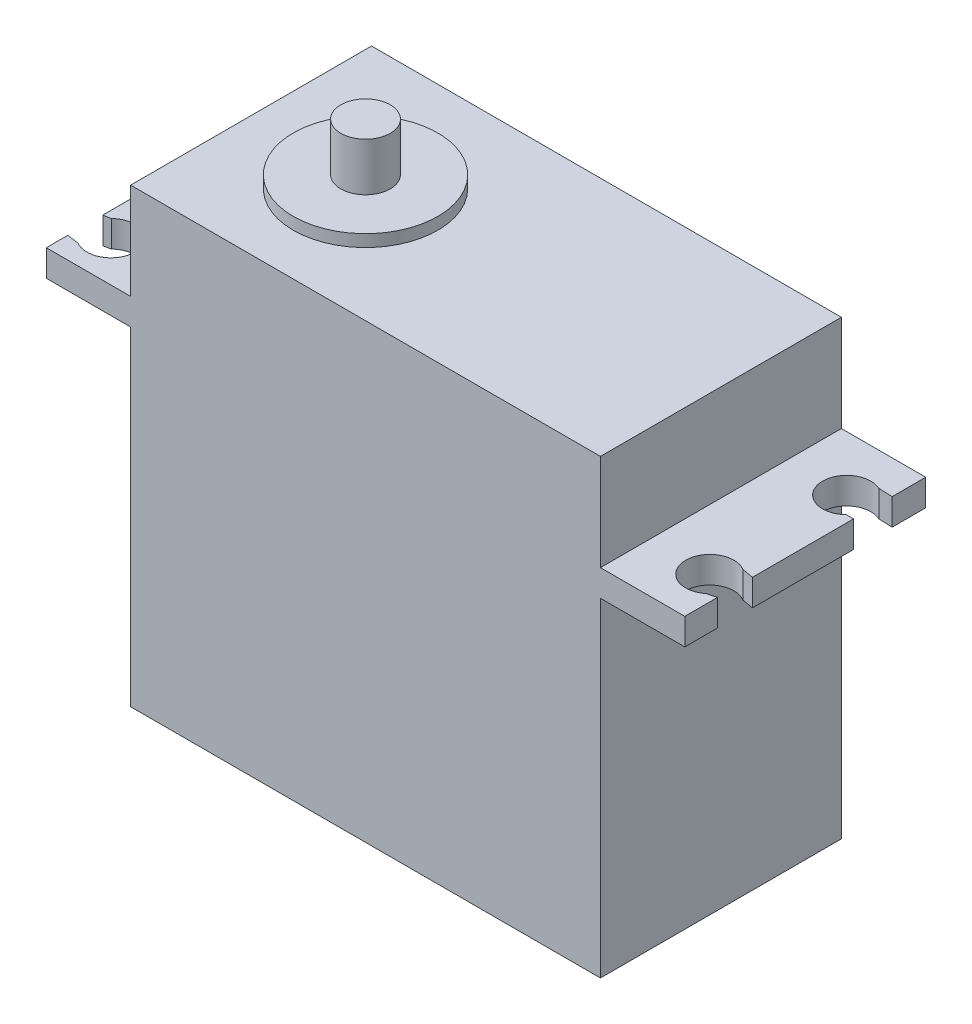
SolidWorks part; units mm, degrees
ref_plane "Front Plane" through (0, 0, 0) normal (0, 0, 1) x (1, 0, 0)
ref_plane "Top Plane" through (0, 0, 0) normal (0, 1, 0) x (1, 0, 0)
ref_plane "Right Plane" through (0, 0, 0) normal (1, 0, 0) x (0, 0, -1)
sketch "Sketch1" plane through (0, 0, 0) normal (0, 1, 0) x (1, 0, 0)
  line L1 (-15.1804, 11.5459) -> (23.8196, 11.5459)
  line L2 (-15.1804, 11.5459) -> (-15.1804, -8.4541)
  line L3 (-15.1804, -8.4541) -> (23.8196, -8.4541)
  line L4 (23.8196, 11.5459) -> (23.8196, -8.4541)
  dimension "D1" = 39
  dimension "D2" = 20
extrude "Boss-Extrude1" add sketch "Sketch1" along normal blind 37.5
sketch "Sketch2" plane through (23.8196, 0, 0) normal (1, 0, 0) x (0, 0, -1)
  line L0 (-8.4541, 37.5) -> (-8.4541, 0) construction
  line L1 (-8.4541, 29.5) -> (11.5459, 29.5)
  line L2 (-8.4541, 29.5) -> (-8.4541, 27.3)
  line L3 (-8.4541, 27.3) -> (11.5459, 27.3)
  line L4 (11.5459, 29.5) -> (11.5459, 27.3)
  line L5 (11.5459, 37.5) -> (11.5459, 0) construction
  line L6 (-8.4541, 37.5) -> (11.5459, 37.5) construction
  dimension "D1" = 8
  dimension "D2" = 2.2
extrude "Boss-Extrude2" add sketch "Sketch2" along normal blind 7 and the other way blind 46
sketch "Sketch3" plane through (0, 29.5, 0) normal (0, 1, 0) x (1, 0, 0)
  line L0 (23.8196, -8.4541) -> (23.8196, 11.5459) construction
  line L1 (-15.1804, 11.5459) -> (-15.1804, -8.4541) construction
  line L2 (30.2197, 5.5607) -> (32.2297, 5.5607)
  line L3 (32.2297, 5.5607) -> (32.2297, 8.7142)
  line L4 (32.2297, 8.7142) -> (29.6675, 8.8004)
  line L5 (32.8585, -3.1959) -> (29.8543, -2.6659)
  line L6 (32.8585, -3.1959) -> (32.8585, -5.2088)
  line L7 (32.8585, -5.2088) -> (30.0828, -5.928)
  line L8 (-25.6091, 8.3083) -> (-25.6091, 6.4028)
  line L9 (-25.6091, 6.4028) -> (-21.5804, 5.5607)
  line L10 (-25.6091, 8.3083) -> (-21.192, 8.7142)
  line L11 (-21.5804, -3.6556) -> (-25.6091, -4.3774)
  line L12 (-25.6091, -4.3774) -> (-25.6091, -6.1712)
  line L13 (-25.6091, -6.1712) -> (-21.192, -6.8091)
  arc A0 (29.6675, 8.8004) -> (30.2197, 5.5607) centre (28.8196, 6.989) ccw
  arc A1 (29.8543, -2.6659) -> (30.0828, -5.928) centre (28.8196, -4.3774) ccw
  arc A2 (-21.5804, 5.5607) -> (-21.192, 8.7142) centre (-20.1804, 6.989) ccw
  arc A3 (-21.192, -6.8091) -> (-21.5804, -3.6556) centre (-20.1804, -5.0838) ccw
  dimension "D3" = 4
  dimension "D1" = 5
  dimension "D2" = 5
extrude "Cut-Extrude3" cut sketch "Sketch3" against normal blind 7
sketch "Sketch5" plane through (0, 37.5, 0) normal (0, 1, 0) x (1, 0, 0)
  line L0 (-15.1804, -8.4541) -> (23.8196, -8.4541) construction
  line L1 (-15.1804, 11.5459) -> (-15.1804, -8.4541) construction
  circle A0 centre (-5.1804, 1.0459) radius 2.0513
  dimension "D1" = 9.5
  dimension "D2" = 10
extrude "Boss-Extrude4" add sketch "Sketch5" along normal blind 5
sketch "Sketch4" plane through (0, 37.5, 0) normal (0, 1, 0) x (1, 0, 0)
  circle A0 centre (-5.1804, 1.0459) radius 6
  point P2 (-5.1804, 1.0459)
  dimension "D1" = 12
extrude "Boss-Extrude5" add sketch "Sketch4" along normal blind 1
